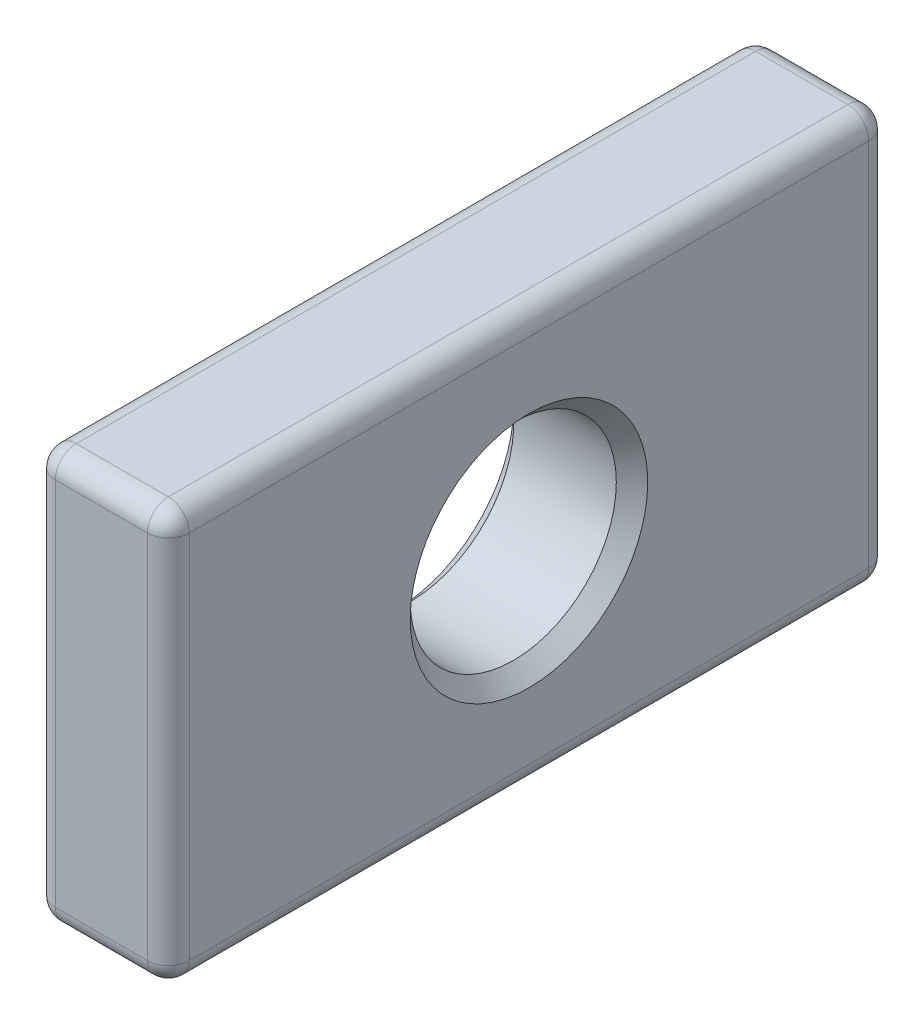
SolidWorks part; units mm, degrees
ref_plane "Front Plane" through (0, 0, 0) normal (0, 0, 1) x (1, 0, 0)
ref_plane "Top Plane" through (0, 0, 0) normal (0, 1, 0) x (1, 0, 0)
ref_plane "Right Plane" through (0, 0, 0) normal (1, 0, 0) x (0, 0, -1)
sketch "Sketch1" plane through (0, 0, 0) normal (1, 0, 0) x (0, 0, -1)
  line L1 (-17.5, 10) -> (17.5, 10)
  line L2 (-17.5, 10) -> (-17.5, -10)
  line L3 (-17.5, -10) -> (17.5, -10)
  line L4 (17.5, 10) -> (17.5, -10)
  line L5 (-17.5, 10) -> (17.5, -10) construction
  line L6 (-17.5, -10) -> (17.5, 10) construction
  circle A0 centre (0, 0) radius 5
  point P0 (0, 0)
  dimension "D3" = 10
  dimension "D1" = 20
  dimension "D2" = 35
extrude "Boss-Extrude1" add sketch "Sketch1" along normal mid plane 6.5
fillet "Fillet1" radius 1.016 12 edges at (0, -10, -17.5) (0, 10, -17.5) (-3.25, 10, 0) (-3.25, -10, 0) (-3.25, 0, -17.5) (0, 10, 17.5) (0, -10, 17.5) (-3.25, 0, 17.5) (3.25, -10, 0) (3.25, 0, 17.5) (3.25, 10, 0) (3.25, 0, -17.5)
chamfer "Chamfer1" distance 0.762 angle 45 2 edges at (-3.25, 0, -5) (3.25, 0, -5)
